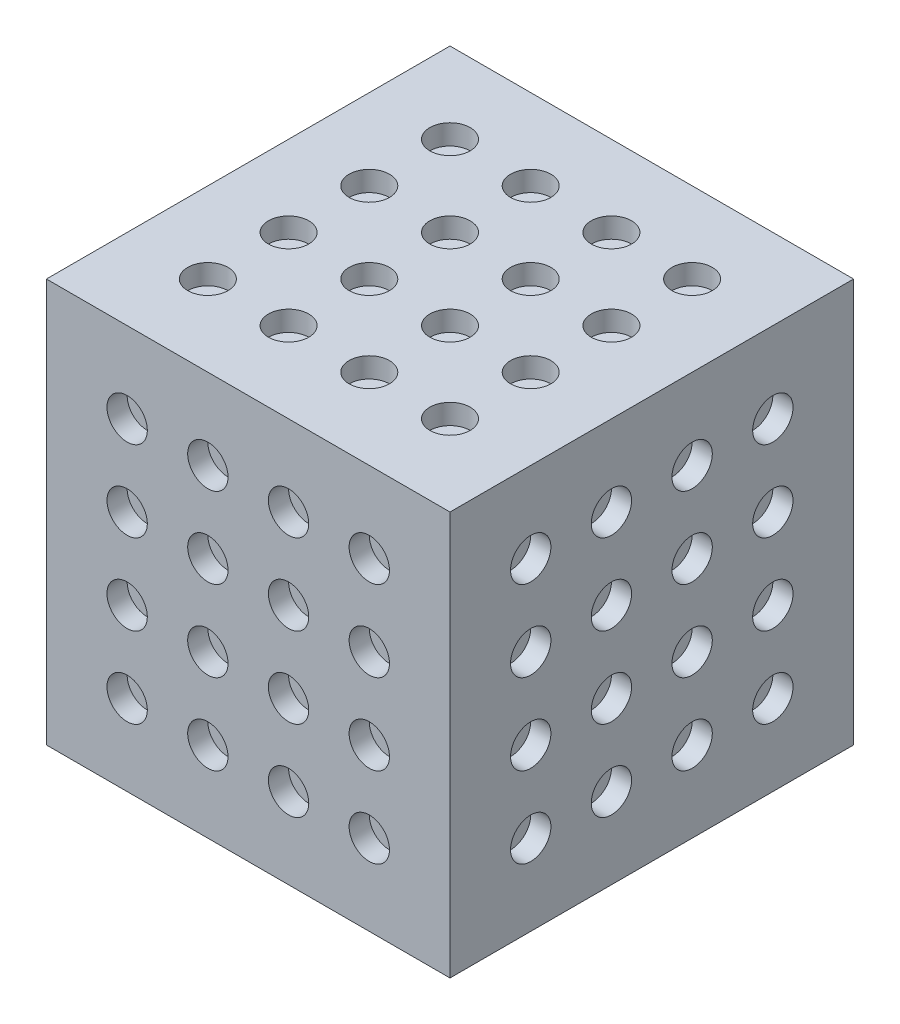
SolidWorks part; units mm, degrees
ref_plane "Ebene vorne" through (0, 0, 0) normal (0, 0, 1) x (1, 0, 0)
ref_plane "Ebene oben" through (0, 0, 0) normal (0, 1, 0) x (1, 0, 0)
ref_plane "Ebene rechts" through (0, 0, 0) normal (1, 0, 0) x (0, 0, -1)
sketch "Skizze1" plane through (0, 0, 0) normal (0, 0, 1) x (1, 0, 0)
  line L1 (0, 0) -> (100, 0)
  line L2 (0, 0) -> (0, 100)
  line L3 (0, 100) -> (100, 100)
  line L4 (100, 0) -> (100, 100)
  dimension "D1" = 100
  dimension "D2" = 100
extrude "Linear austragen1" add sketch "Skizze1" along normal blind 100
sketch "Skizze2" plane through (0, 0, 100) normal (0, 0, 1) x (1, 0, 0)
  line L0 (0, 100) -> (0, 0) construction
  line L1 (100, 100) -> (0, 100) construction
  circle A0 centre (20, 80) radius 5
  dimension "D2" = 20
  dimension "D3" = 10
  dimension "D1" = 20
extrude "Linear austragen2" cut sketch "Skizze2" against normal blind 5
pattern_linear "Lineares Muster1" count 4 spacing 20 along (1, 0, 0) count 4 spacing 20 along (0, -1, 0) of "Linear austragen2"
sketch "Skizze3" plane through (100, 0, 0) normal (1, 0, 0) x (0, 0, -1)
  line L0 (-100, 0) -> (-100, 100) construction
  line L1 (-100, 100) -> (0, 100) construction
  circle A0 centre (-80, 80) radius 5
  dimension "D1" = 20
  dimension "D2" = 20
  dimension "D3" = 10
extrude "Linear austragen3" cut sketch "Skizze3" against normal blind 5
pattern_linear "Lineares Muster2" count 4 spacing 20 along (0, 0, -1) count 4 spacing 20 along (0, -1, 0) of "Linear austragen3"
sketch "Skizze4" plane through (0, 100, 0) normal (0, 1, 0) x (-1, 0, 0)
  line L0 (-100, 100) -> (0, 100) construction
  line L1 (0, 100) -> (0, 0) construction
  circle A0 centre (-20, 80) radius 5
  dimension "D1" = 20
  dimension "D2" = 20
  dimension "D3" = 10
extrude "Linear austragen4" cut sketch "Skizze4" against normal blind 5
pattern_linear "Lineares Muster3" count 4 spacing 20 along (0, 0, -1) count 4 spacing 20 along (1, 0, 0) of "Linear austragen4"
